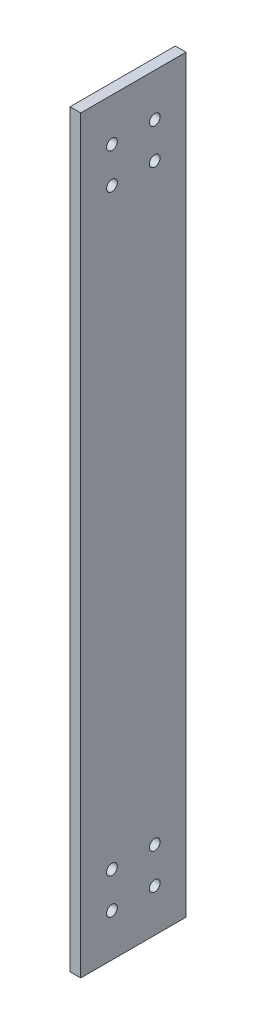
SolidWorks part; units mm, degrees
ref_plane "Front Plane" through (0, 0, 0) normal (0, 0, 1) x (1, 0, 0)
ref_plane "Top Plane" through (0, 0, 0) normal (0, 1, 0) x (1, 0, 0)
ref_plane "Right Plane" through (0, 0, 0) normal (1, 0, 0) x (0, 0, -1)
sketch "Sketch1" plane through (0, 0, 0) normal (1, 0, 0) x (0, 0, -1)
  line L1 (-14.75, -105) -> (14.75, -105)
  line L2 (-14.75, -105) -> (-14.75, 105)
  line L3 (-14.75, 105) -> (14.75, 105)
  line L4 (14.75, -105) -> (14.75, 105)
  line L5 (-14.75, -105) -> (14.75, 105) construction
  line L6 (-14.75, 105) -> (14.75, -105) construction
  point P0 (0, 0)
  dimension "D1" = 210
  dimension "D2" = 29.5
extrude "Boss-Extrude1" add sketch "Sketch1" along normal blind 3
sketch "Sketch2" plane through (3, 0, 0) normal (1, 0, 0) x (0, 0, -1)
  line L0 (-14.75, -93) -> (14.75, -93) construction
  line L1 (-14.75, 105) -> (-14.75, -105) construction
  line L2 (14.75, -105) -> (14.75, 105) construction
  line L3 (-14.75, -83) -> (14.75, -83) construction
  line L4 (0, 105) -> (0, -105) construction
  line L5 (14.75, 105) -> (-14.75, 105) construction
  line L6 (-14.75, -105) -> (14.75, -105) construction
  line L7 (-14.75, 93) -> (14.75, 93) construction
  line L8 (-14.75, 83) -> (14.75, 83) construction
  circle A0 centre (6, 93) radius 1.5
  circle A1 centre (6, 83) radius 1.5
  circle A2 centre (-6, 93) radius 1.5
  circle A3 centre (-6, 83) radius 1.5
  circle A4 centre (6, -93) radius 1.5
  circle A5 centre (6, -83) radius 1.5
  circle A6 centre (-6, -83) radius 1.5
  circle A7 centre (-6, -93) radius 1.5
  dimension "D6" = 3
  dimension "D8" = 3
  dimension "D10" = 3
  dimension "D12" = 3
  dimension "D15" = 3
  dimension "D16" = 3
  dimension "D17" = 3
  dimension "D18" = 3
  dimension "D1" = 12
  dimension "D2" = 10
  dimension "D3" = 12
  dimension "D4" = 10
  dimension "D5" = 6
  dimension "D7" = 6
  dimension "D9" = 6
  dimension "D11" = 6
  dimension "D13" = 6
  dimension "D14" = 6
  dimension "D19" = 6
  dimension "D20" = 6
extrude "Cut-Extrude1" cut sketch "Sketch2" against normal through all
